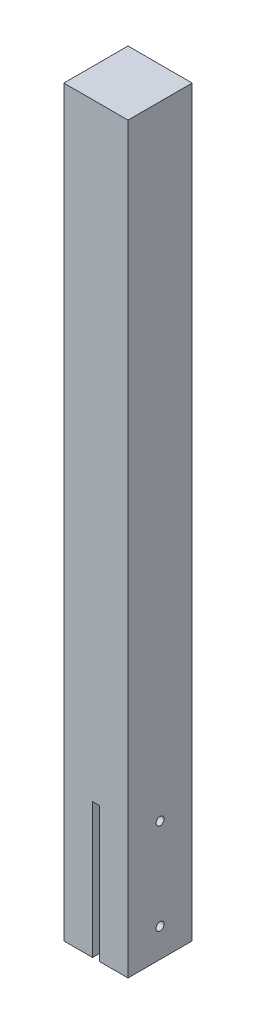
SolidWorks part; units mm, degrees
ref_plane "Front Plane" through (0, 0, 0) normal (0, 0, 1) x (1, 0, 0)
ref_plane "Top Plane" through (0, 0, 0) normal (0, 1, 0) x (1, 0, 0)
ref_plane "Right Plane" through (0, 0, 0) normal (1, 0, 0) x (0, 0, -1)
sketch "Sketch stolphöjd" plane through (0, 0, 0) normal (0, 0, 1) x (1, 0, 0)
  line L0 (0, 0) -> (0, 1100) construction
  line L1 (-47.5, 1100) -> (47.5, 1100) construction
  dimension "D1" = 1100
  dimension "D2" = 95
ref_plane "Lutande topplan" through (0, 945.6369, 382.0621) normal (0, 0.9272, 0.3746) x (-1, 0, 0)
sketch "Sketch2" plane through (0, 0, 0) normal (0, 1, 0) x (1, 0, 0)
  line L8 (-47.5, 0) -> (47.5, 0) construction
  line L9 (47.5, 47.5) -> (-47.5, 47.5)
  line L10 (47.5, 47.5) -> (47.5, -47.5)
  line L11 (47.5, -47.5) -> (-47.5, -47.5)
  line L12 (-47.5, 47.5) -> (-47.5, -47.5)
  dimension "D1" = 95
extrude "Extrude höjd" add sketch "Sketch2" along normal up to vertex (1100 mm away)
sketch "Sketch10" plane through (0, 0, 0) normal (0, -1, 0) x (-1, 0, 0)
  line L0 (0, 0) -> (0, -47.5) construction
  line L2 (47.5, -47.5) -> (-47.5, -47.5) construction
  line L3 (5, 47.5) -> (-5, 47.5)
  line L4 (5, 47.5) -> (5, -47.5)
  line L5 (5, -47.5) -> (-5, -47.5)
  line L6 (-5, 47.5) -> (-5, -47.5)
  line L7 (0, 47.5) -> (0, -47.5) construction
  line L8 (5, 0) -> (-5, 0) construction
  dimension "D1" = 10
extrude "Cut-slits för stolpfot" cut sketch "Sketch10" against normal blind 200
sketch "Sketch8" plane through (0, -97.5, 0) normal (-1, 0, 0) x (0, 1, 0)
  line L0 (97.5, -52.25) -> (97.5, 52.25) construction
  line L1 (97.5, 0) -> (275, 0) construction
  line L2 (45.25, 0) -> (149.75, 0) construction
  circle A0 centre (275, 0) radius 6
  circle A1 centre (140, 0) radius 6
  dimension "D1" = 177.5
  dimension "D2" = 12
  dimension "D3" = 135
extrude "Cut-skruvhål för stolpfot" cut sketch "Sketch8" along normal up to next and the other way up to next
sketch "Sketch12" plane through (0, 1100, 0) normal (0, 1, 0) x (1, 0, 0)
  line L2 (47.5, -47.5) -> (47.5, 47.5) construction
  line L4 (-47.5, 47.5) -> (-47.5, -47.5) construction
  line L5 (47.5, 47.5) -> (-47.5, 47.5) construction
  line L6 (47.5, 0) -> (47.5, 47.5)
  line L7 (-47.5, 47.5) -> (-47.5, 0)
  line L8 (-47.5, 0) -> (47.5, 0) construction
  line L9 (-47.5, 0) -> (47.5, 0)
  line L10 (47.5, 47.5) -> (-47.5, 47.5)
extrude "Extrude lutande topp" add sketch "Sketch12" along normal up to surface
sketch "Sketch13" plane through (0, 1100, 530.8171) normal (0, -1, 0) x (1, 0, 0)
  line L0 (47.5, -483.3171) -> (47.5, -530.8171) construction
  line L1 (-47.5, -483.3171) -> (47.5, -483.3171) construction
  line L2 (-47.5, -530.8171) -> (-47.5, -483.3171) construction
  line L3 (47.5, -483.3171) -> (47.5, -530.8171)
  line L7 (-47.5, -483.3171) -> (47.5, -483.3171)
  line L8 (-47.5, -530.8171) -> (-47.5, -483.3171)
  line L10 (-47.5, -530.8171) -> (47.5, -530.8171) construction
  line L11 (-47.5, -530.8171) -> (47.5, -530.8171)
extrude "Cut-lutande topp" cut sketch "Sketch13" along normal up to surface (19.1912 mm away)
sketch "Sketch14" plane through (0, 1100, 0) normal (0, 1, 0) x (1, 0, 0)
  line L4 (47.5, 47.5) -> (-47.5, 47.5) construction
  line L5 (47.5, -47.5) -> (47.5, 47.5) construction
  line L6 (-47.5, -47.5) -> (47.5, -47.5) construction
  line L7 (-47.5, 47.5) -> (-47.5, -47.5) construction
  line L8 (47.5, 47.5) -> (-47.5, 47.5)
  line L9 (47.5, -47.5) -> (47.5, 47.5)
  line L10 (-47.5, -47.5) -> (47.5, -47.5)
  line L11 (-47.5, 47.5) -> (-47.5, -47.5)
extrude "Extrude tätraedertopp" add sketch "Sketch14" along normal blind 16 draft 72
sketch "Sketch15" plane through (0, 1100, 0) normal (0, 1, 0) x (-1, 0, 0)
  line L0 (-47.5, 47.5) -> (-27.701, 27.701) construction
  line L1 (-27.701, 27.701) -> (27.701, -27.701) construction
  line L2 (27.701, -27.701) -> (47.5, -47.5) construction
  circle A2 centre (27.701, -27.701) radius 5
  circle A3 centre (-27.701, 27.701) radius 5
  dimension "D2" = 10
  dimension "D1" = 28
extrude "Cut-tapphål" cut sketch "Sketch15" against normal blind 15
fillet "Fillet tätraeder" radius 3
fillet "Fillet lutande toppkanter" radius 3
fillet "Fille stolpkanter vid tetraeder" radius 3
fillet "Fillet stolpkanter vid lutande topp" radius 3
fillet "Fillet stolpkanter vid plan topp" radius 3
